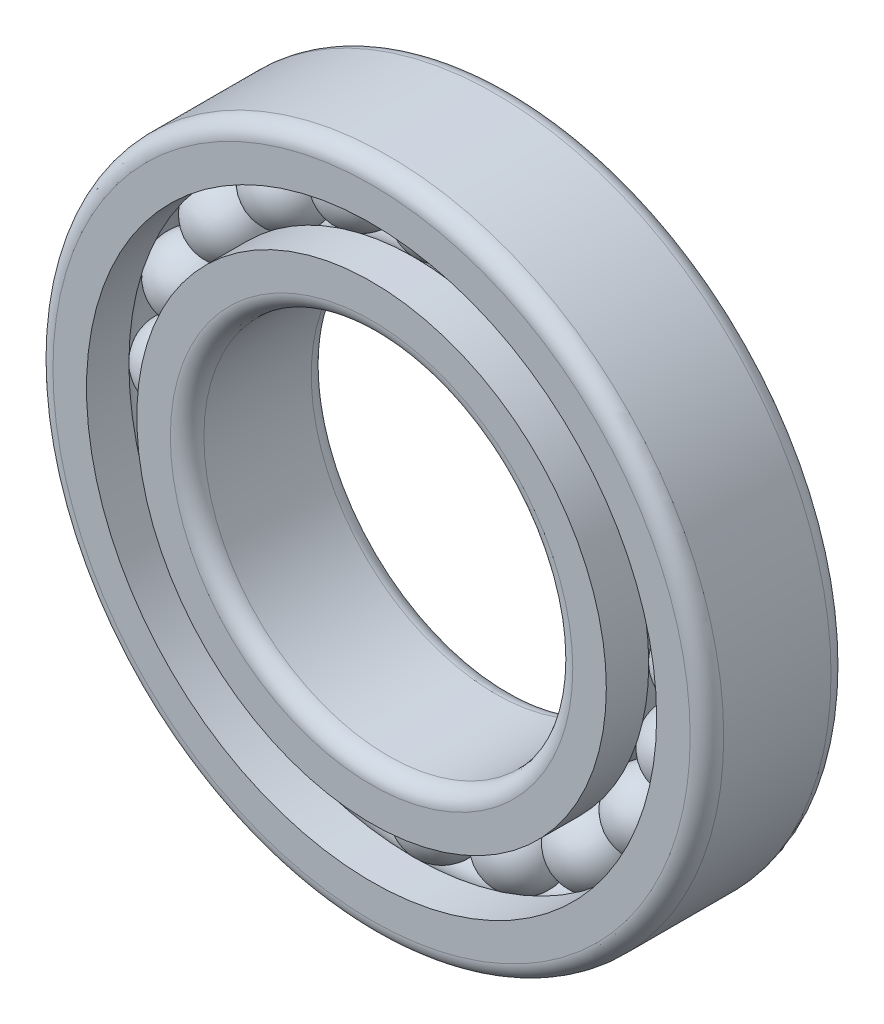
SolidWorks part; units mm, degrees
ref_plane "Front Plane" through (0, 0, 0) normal (0, 0, 1) x (1, 0, 0)
ref_plane "Top Plane" through (0, 0, 0) normal (0, 1, 0) x (1, 0, 0)
ref_plane "Right Plane" through (0, 0, 0) normal (1, 0, 0) x (0, 0, -1)
other "Configuration Table"
sketch "BaseSke" plane through (0, 0, 0) normal (1, 0, 0) x (0, 0, -1)
  line L0 (-47.2296, 0) -> (24.6132, 0) construction
  line L1 (-47.2296, 38.75) -> (24.6132, 38.75) construction
  line L2 (0, 129.5214) -> (0, -86.3012) construction
  line L3 (0, 44.375) -> (0, 33.125)
  line L4 (-10.5, 50) -> (10.5, 50) construction
  line L5 (-10.5, 27.5) -> (10.5, 27.5) construction
  arc A0 (0, 44.375) -> (0, 33.125) centre (0, 38.75) ccw
revolve "Ball" add sketch "BaseSke" angle 360 about L3
sketch "OuterRaceSke" plane through (0, 0, 0) normal (1, 0, 0) x (0, 0, -1)
  line L0 (0, 0) -> (0, 87.5396) construction
  line L1 (-10.5, 50) -> (10.5, 50)
  line L2 (-10.5, 50) -> (-10.5, 42.5)
  line L3 (-10.5, 42.5) -> (-4.1792, 42.5)
  line L4 (10.5, 50) -> (10.5, 42.5)
  line L5 (-50.3916, 0) -> (55.2197, 0) construction
  line L6 (-47.2296, 38.75) -> (24.6132, 38.75) construction
  line L7 (4.1792, 42.5) -> (10.5, 42.5)
  arc A0 (4.1792, 42.5) -> (-4.1792, 42.5) centre (0, 38.75) ccw
revolve "OuterRace" add sketch "OuterRaceSke" angle 360 about L5
sketch "InnerRaceSke" plane through (0, 0, 0) normal (1, 0, 0) x (0, 0, -1)
  line L0 (-70.8626, 0) -> (113.5527, 0) construction
  line L1 (0, 58.441) -> (0, -70.8113) construction
  line L2 (-10.5, 27.5) -> (10.5, 27.5)
  line L3 (-10.5, 27.5) -> (-10.5, 35)
  line L4 (-10.5, 35) -> (-4.1792, 35)
  line L5 (10.5, 27.5) -> (10.5, 35)
  line L6 (0, 129.5214) -> (0, -86.3012) construction
  line L7 (4.1792, 35) -> (10.5, 35)
  arc A0 (-4.1792, 35) -> (4.1792, 35) centre (0, 38.75) ccw
  arc A1 (0, 44.375) -> (0, 33.125) centre (0, 38.75) ccw construction
revolve "InnerRace" add sketch "InnerRaceSke" angle 360 about L0
fillet "Fillet1" radius 2.5 4 edges at (27.5, 0, -10.5) (27.5, 0, 10.5) (50, 0, -10.5) (50, 0, 10.5)
sketch "ShieldedSke" plane through (0, 0, 0) normal (1, 0, 0) x (0, 0, -1)
  line L1 (-9.25, 42.5) -> (-7, 42.5)
  line L2 (-10.5, 41.25) -> (-10.5, 36.25)
  line L3 (-9.25, 35) -> (-7, 35)
  line L4 (-7, 42.5) -> (-7, 35)
  arc A0 (-9.25, 42.5) -> (-10.5, 41.25) centre (-9.25, 41.25) ccw
  arc A1 (-10.5, 36.25) -> (-9.25, 35) centre (-9.25, 36.25) ccw
  point P12 (-10.5, 42.5)
  point P13 (-10.5, 35)
revolve "Shielded" [suppressed] add sketch "ShieldedSke" angle 360 about L0
mirror "DoubleShielded" [suppressed] about plane through (0, 0, 0) normal (0, 0, 1)
sketch "SealedSke" plane through (0, 0, 0) normal (1, 0, 0) x (0, 0, -1)
  line L0 (-34.5153, 0) -> (39.09, 0) construction
  line L1 (-28.4, 35) -> (-8.4, 35)
  line L2 (-28.4, 35) -> (-28.4, 42.5)
  line L3 (-28.4, 42.5) -> (-8.4, 42.5)
  line L4 (-8.4, 35) -> (-8.4, 42.5)
revolve "Sealed" [suppressed] cut sketch "SealedSke" angle 360 about L0
mirror "DoubleSealed" [suppressed] about plane through (0, 0, 0) normal (0, 0, 1)
pattern_circular "CirPatternBall" count 20 over 360 about axis through (0, 0, 0) along (0, 0, 1) of "Ball"
sketch "CutGrooveSke" plane through (0, 0, 0) normal (1, 0, 0) x (0, 0, -1)
  line L0 (-51.8407, 0) -> (83.8302, 0) construction
  line L1 (6.3, -69) -> (5.25, -69)
  line L2 (6.3, -69) -> (6.3, -49)
  line L3 (6.3, -49) -> (5.25, -49)
  line L4 (5.25, -69) -> (5.25, -49)
revolve "CutGroove" [suppressed] cut sketch "CutGrooveSke" angle 360 about L0
sketch "TaperSke" plane through (0, 0, 0) normal (1, 0, 0) x (0, 0, -1)
  line L0 (-10.5, 27.5) -> (10.5, 27.5)
  line L1 (10.5, 27.5) -> (10.5, 29.25)
  line L2 (10.5, 29.25) -> (-10.5, 27.5)
  line L7 (-41.2502, 0) -> (40.8606, 0) construction
revolve "Taper" [suppressed] cut sketch "TaperSke" angle 360 about L7
fillet "Fillet2" [suppressed] radius 2.5
sketch "SimplifiedSke" plane through (0, 0, 0) normal (1, 0, 0) x (0, 0, -1)
  line L0 (37.5911, 0) -> (-37.5911, 0) construction
  circle A0 centre (0, 38.75) radius 5.625
  arc A1 (0, 44.375) -> (0, 33.125) centre (0, 38.75) ccw construction
revolve "Simplified" [suppressed] add sketch "SimplifiedSke" angle 360 about L0
equation "\"D1@BaseSke\" =  (\"Bearing_Outside_Diameter@BaseSke\"  +  \"Bearing_Inside_Diameter@BaseSke\"  )  / 4"
equation "\"Ball_diameter@BaseSke\" =  ( \"Bearing_Outside_Diameter@BaseSke\" - \"Bearing_Inside_Diameter@BaseSke\" ) / 4 "
equation "\"D2@OuterRaceSke\" = \"Bearing_Outside_Diameter@BaseSke\" -  ( \"Bearing_Outside_Diameter@BaseSke\" - \"Bearing_Inside_Diameter@BaseSke\" )  / 3"
equation "\"D4@OuterRaceSke\" = (  \"Bearing_Outside_Diameter@BaseSke\" - \"Bearing_Inside_Diameter@BaseSke\" ) / 4 -0.02"
equation "\"D1@InnerRaceSke\" = \"Bearing_Inside_Diameter@BaseSke\" +  ( \"Bearing_Outside_Diameter@BaseSke\" - \"Bearing_Inside_Diameter@BaseSke\" )  / 3"
equation "\"D2@InnerRaceSke\" = \"D4@OuterRaceSke\""
equation "\"D1@ShieldedSke\" = \"Fillet_radius@Fillet1\"/2"
equation "\"D2@ShieldedSke\" = \"Bearing_Thickness@BaseSke\"/3"
equation "\"D2@SealedSke\" = \"Bearing_Thickness@BaseSke\"/2.5"
equation "\"D1@CirPatternBall\" = int( \"D1@BaseSke\"* pi  * 2 / \"Ball_diameter@BaseSke\" ) -1"
equation "\"D1@CutGrooveSke\" = \"Bearing_Outside_Diameter@BaseSke\" * 0.49"
equation "\"D2@CutGrooveSke\" = \"Bearing_Thickness@BaseSke\" *0.25"
equation "\"D3@CutGrooveSke\" = \"Bearing_Thickness@BaseSke\"/20"
equation "\"Taper@TaperSke\" = \"Bearing_Thickness@BaseSke\"/12"
equation "\"D1@Fillet2\" = \"Fillet_radius@Fillet1\""
